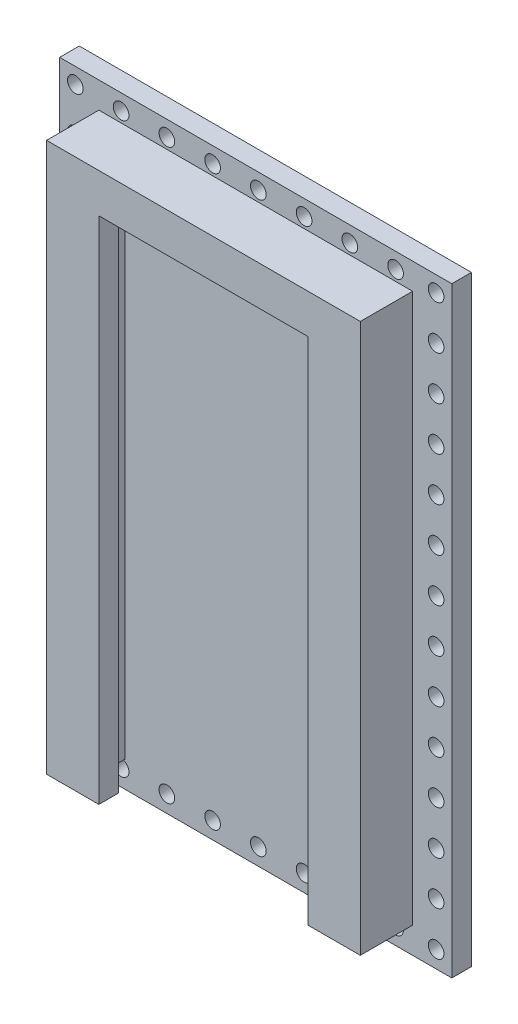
SolidWorks part; units mm, degrees
ref_plane "Alzado" through (0, 0, 0) normal (0, 0, 1) x (1, 0, 0)
ref_plane "Planta" through (0, 0, 0) normal (0, 1, 0) x (1, 0, 0)
ref_plane "Vista lateral" through (0, 0, 0) normal (1, 0, 0) x (0, 0, -1)
sketch "Sketch1" plane through (0, 0, 0) normal (0, 0, 1) x (1, 0, 0)
  line L1 (-15, -23) -> (15, -23)
  line L2 (-15, -23) -> (-15, 23)
  line L3 (-15, 23) -> (15, 23)
  line L4 (15, -23) -> (15, 23)
  line L5 (-15, -23) -> (15, 23) construction
  line L6 (-15, 23) -> (15, -23) construction
  point P0 (0, 0)
  dimension "D1" = 46
  dimension "D2" = 30
extrude "Boss-Extrude1" add sketch "Sketch1" along normal blind 1 and the other way blind 0.5
sketch "Sketch2" plane through (0, 0, 1) normal (0, 0, 1) x (1, 0, 0)
  line L0 (-15, 23) -> (-15, -23) construction
  line L1 (15, 23) -> (-15, 23) construction
  line L2 (-15, -23) -> (15, -23) construction
  line L3 (15, -23) -> (15, 23) construction
  circle A0 centre (-13.8, 21.8) radius 0.6
  circle A1 centre (-13.8, 18.4538) radius 0.6
  circle A2 centre (-13.8, 15.1077) radius 0.6
  circle A3 centre (-13.8, 11.7615) radius 0.6
  circle A4 centre (-13.8, 8.4154) radius 0.6
  circle A5 centre (-13.8, 5.0692) radius 0.6
  circle A6 centre (-13.8, 1.7231) radius 0.6
  circle A7 centre (-13.8, -1.6231) radius 0.6
  circle A8 centre (-13.8, -4.9692) radius 0.6
  circle A9 centre (-13.8, -8.3154) radius 0.6
  circle A10 centre (-13.8, -11.6615) radius 0.6
  circle A11 centre (-13.8, -15.0077) radius 0.6
  circle A12 centre (-13.8, -18.3538) radius 0.6
  circle A13 centre (-13.8, -21.7) radius 0.6
  circle A14 centre (13.8, 21.8) radius 0.6
  circle A15 centre (13.8, 18.4538) radius 0.6
  circle A16 centre (13.8, 15.1077) radius 0.6
  circle A17 centre (13.8, 11.7615) radius 0.6
  circle A18 centre (13.8, 8.4154) radius 0.6
  circle A19 centre (13.8, 5.0692) radius 0.6
  circle A20 centre (13.8, 1.7231) radius 0.6
  circle A21 centre (13.8, -1.6231) radius 0.6
  circle A22 centre (13.8, -4.9692) radius 0.6
  circle A23 centre (13.8, -8.3154) radius 0.6
  circle A24 centre (13.8, -11.6615) radius 0.6
  circle A25 centre (13.8, -15.0077) radius 0.6
  circle A26 centre (13.8, -18.3538) radius 0.6
  circle A27 centre (13.8, -21.7) radius 0.6
  circle A28 centre (-10.3, 21.8) radius 0.6
  circle A29 centre (-6.8, 21.8) radius 0.6
  circle A30 centre (-3.3, 21.8) radius 0.6
  circle A31 centre (0.2, 21.8) radius 0.6
  circle A32 centre (3.7, 21.8) radius 0.6
  circle A33 centre (7.2, 21.8) radius 0.6
  circle A34 centre (10.7, 21.8) radius 0.6
  circle A35 centre (-10.3, -21.7) radius 0.6
  circle A36 centre (-6.8, -21.7) radius 0.6
  circle A37 centre (-3.3, -21.7) radius 0.6
  circle A38 centre (0.2, -21.7) radius 0.6
  circle A39 centre (3.7, -21.7) radius 0.6
  circle A40 centre (7.2, -21.7) radius 0.6
  circle A41 centre (10.7, -21.7) radius 0.6
extrude "Cut-Extrude1" cut sketch "Sketch2" against normal blind 9
sketch "Sketch3" plane through (0, 0, 1) normal (0, 0, 1) x (1, 0, 0)
  line L0 (-8, -21) -> (-8, 18)
  line L1 (-12, -21) -> (-8, -21)
  line L2 (-12, -21) -> (-12, 21)
  line L3 (-12, 21) -> (12, 21)
  line L4 (12, -21) -> (12, 21)
  line L5 (-12, -21) -> (12, 21) construction
  line L6 (-12, 21) -> (12, -21) construction
  line L7 (-8, 18) -> (8, 18)
  line L8 (8, 18) -> (8, -21)
  line L9 (8, -21) -> (12, -21)
  point P0 (0, 0)
extrude "Boss-Extrude2" add sketch "Sketch3" along normal blind 4
sketch "Sketch4" plane through (0, -21, 0) normal (0, -1, 0) x (1, 0, 0)
  line L0 (8, 1) -> (12, 1) construction
  line L1 (-10, 3.5) -> (10, 3.5)
  line L2 (-10, 3.5) -> (-10, 1)
  line L3 (-10, 1) -> (10, 1)
  line L4 (10, 3.5) -> (10, 1)
  line L5 (-10, 3.5) -> (10, 1) construction
  line L6 (-10, 1) -> (10, 3.5) construction
  point P0 (0, 2.25)
  dimension "D1" = 20
  dimension "D2" = 2.5
extrude "Cut-Extrude2" cut sketch "Sketch4" against normal up to surface (39 mm away)
equation "\"hoyo\"=1.2"
equation "\"D1@Sketch2\"=\"hoyo\""
equation "\"D2@Sketch2\"=\"hoyo\""
equation "\"D3@Sketch2\"=\"hoyo\""
equation "\"space\"=4"
equation "\"D4@Sketch3\"=\"space\""
equation "\"iman\"=10"
